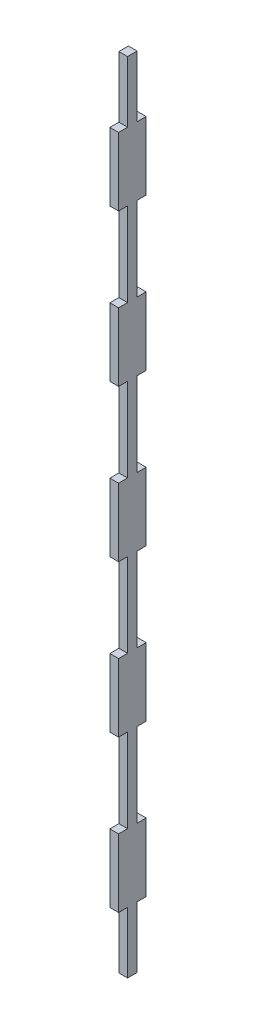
SolidWorks part; units mm, degrees
ref_plane "Plan de face" through (0, 0, 0) normal (0, 0, 1) x (1, 0, 0)
ref_plane "Plan de dessus" through (0, 0, 0) normal (0, 1, 0) x (1, 0, 0)
ref_plane "Plan de droite" through (0, 0, 0) normal (1, 0, 0) x (0, 0, -1)
sketch "Esquisse1" plane through (-123.5, 0, 0) normal (-1, 0, 0) x (0, 0, 1)
  line L0 (0, -108.6) -> (3, -108.6)
  line L1 (0, -108.5) -> (2.9, -108.5) construction
  line L2 (2.9, -108.5) -> (2.9, -86) construction
  line L3 (2.9, -86) -> (0, -86) construction
  line L4 (3, -108.6) -> (3, -85.9)
  line L5 (0, 94) -> (2.9, 94) construction
  line L6 (2.9, 94) -> (2.9, 116.5) construction
  line L7 (2.9, 116.5) -> (0, 116.5) construction
  line L8 (3, -85.9) -> (0, -85.9)
  line L9 (0, 43.375) -> (2.9, 43.375) construction
  line L10 (2.9, 43.375) -> (2.9, 65.875) construction
  line L11 (2.9, 65.875) -> (0, 65.875) construction
  line L12 (0, 93.9) -> (3, 93.9)
  line L13 (0, -7.25) -> (2.9, -7.25) construction
  line L14 (2.9, -7.25) -> (2.9, 15.25) construction
  line L15 (2.9, 15.25) -> (0, 15.25) construction
  line L16 (3, 93.9) -> (3, 116.6)
  line L17 (0, -57.875) -> (2.9, -57.875) construction
  line L18 (2.9, -57.875) -> (2.9, -35.375) construction
  line L19 (2.9, -35.375) -> (0, -35.375) construction
  line L21 (0, -108.5) -> (2.9, -108.5) construction
  line L22 (2.9, -108.5) -> (2.9, -86) construction
  line L23 (2.9, -86) -> (0, -86) construction
  line L25 (0, 94) -> (2.9, 94) construction
  line L26 (2.9, 94) -> (2.9, 116.5) construction
  line L27 (2.9, 116.5) -> (0, 116.5) construction
  line L29 (0, 43.375) -> (2.9, 43.375) construction
  line L30 (2.9, 43.375) -> (2.9, 65.875) construction
  line L31 (2.9, 65.875) -> (0, 65.875) construction
  line L33 (0, -7.25) -> (2.9, -7.25) construction
  line L34 (2.9, -7.25) -> (2.9, 15.25) construction
  line L35 (2.9, 15.25) -> (0, 15.25) construction
  line L37 (0, -57.875) -> (2.9, -57.875) construction
  line L38 (2.9, -57.875) -> (2.9, -35.375) construction
  line L39 (2.9, -35.375) -> (0, -35.375) construction
  line L40 (3, 116.6) -> (0, 116.6)
  line L41 (0, 43.275) -> (3, 43.275)
  line L42 (3, 43.275) -> (3, 65.975)
  line L43 (3, 65.975) -> (0, 65.975)
  line L44 (0, -7.35) -> (3, -7.35)
  line L45 (3, -7.35) -> (3, 15.35)
  line L46 (3, 15.35) -> (0, 15.35)
  line L47 (0, -57.975) -> (3, -57.975)
  line L48 (3, -57.975) -> (3, -35.275)
  line L49 (3, -35.275) -> (0, -35.275)
  line L50 (0, -108.6) -> (0, -129)
  line L51 (0, -85.9) -> (0, -57.975)
  line L52 (0, -35.275) -> (0, -7.35)
  line L53 (0, 43.275) -> (0, 15.35)
  line L54 (0, 93.9) -> (0, 65.975)
  line L55 (0, 116.6) -> (0, 137)
  line L56 (-1.6, -142.199) -> (-1.6, 197.4986) construction
  line L57 (0, 142) -> (0, 110.4444) construction
  line L58 (-3.2, 142) -> (-3.2, 110.4444) construction
  line L59 (-6.1, -35.375) -> (-3.2, -35.375) construction
  line L60 (-6.1, -57.875) -> (-6.1, -35.375) construction
  line L61 (-3.2, -57.875) -> (-6.1, -57.875) construction
  line L62 (-6.1, 15.25) -> (-3.2, 15.25) construction
  line L63 (-6.1, -7.25) -> (-6.1, 15.25) construction
  line L64 (-3.2, -7.25) -> (-6.1, -7.25) construction
  line L65 (-6.1, 65.875) -> (-3.2, 65.875) construction
  line L66 (-6.1, 43.375) -> (-6.1, 65.875) construction
  line L67 (-3.2, 43.375) -> (-6.1, 43.375) construction
  line L68 (-6.1, 94) -> (-6.1, 116.5) construction
  line L69 (-3.2, 94) -> (-6.1, 94) construction
  line L70 (-6.1, -86) -> (-3.2, -86) construction
  line L71 (-6.1, -108.5) -> (-6.1, -86) construction
  line L72 (-3.2, -108.5) -> (-6.1, -108.5) construction
  line L73 (-3.2, 93.9) -> (-3.2, 65.975)
  line L74 (-3.2, 43.275) -> (-3.2, 15.35)
  line L75 (-3.2, -35.275) -> (-3.2, -7.35)
  line L76 (-3.2, -85.9) -> (-3.2, -57.975)
  line L77 (-3.2, -108.6) -> (-3.2, -129)
  line L78 (-6.2, -35.275) -> (-3.2, -35.275)
  line L79 (-6.2, -57.975) -> (-6.2, -35.275)
  line L80 (-3.2, -57.975) -> (-6.2, -57.975)
  line L81 (-6.2, 15.35) -> (-3.2, 15.35)
  line L82 (-6.2, -7.35) -> (-6.2, 15.35)
  line L83 (-3.2, -7.35) -> (-6.2, -7.35)
  line L84 (-6.2, 65.975) -> (-3.2, 65.975)
  line L85 (-6.2, 43.275) -> (-6.2, 65.975)
  line L86 (-3.2, 43.275) -> (-6.2, 43.275)
  line L87 (-6.2, 93.9) -> (-6.2, 116.6)
  line L88 (-3.2, 93.9) -> (-6.2, 93.9)
  line L89 (-6.2, -85.9) -> (-3.2, -85.9)
  line L90 (-6.2, -108.6) -> (-6.2, -85.9)
  line L91 (-3.2, -108.6) -> (-6.2, -108.6)
  line L92 (-6.1, 116.5) -> (-3.2, 116.5) construction
  line L93 (-3.2, 116.6) -> (-3.2, 137)
  line L94 (-6.2, 116.6) -> (-3.2, 116.6)
  line L95 (-3.2, 137) -> (0, 137)
  line L96 (0, -129) -> (-3.2, -129)
  dimension "D2" = 2
  dimension "D3" = 5
  dimension "D1" = 0.1
extrude "Boss.-Extru.1" add sketch "Esquisse1" along normal blind 2.9
